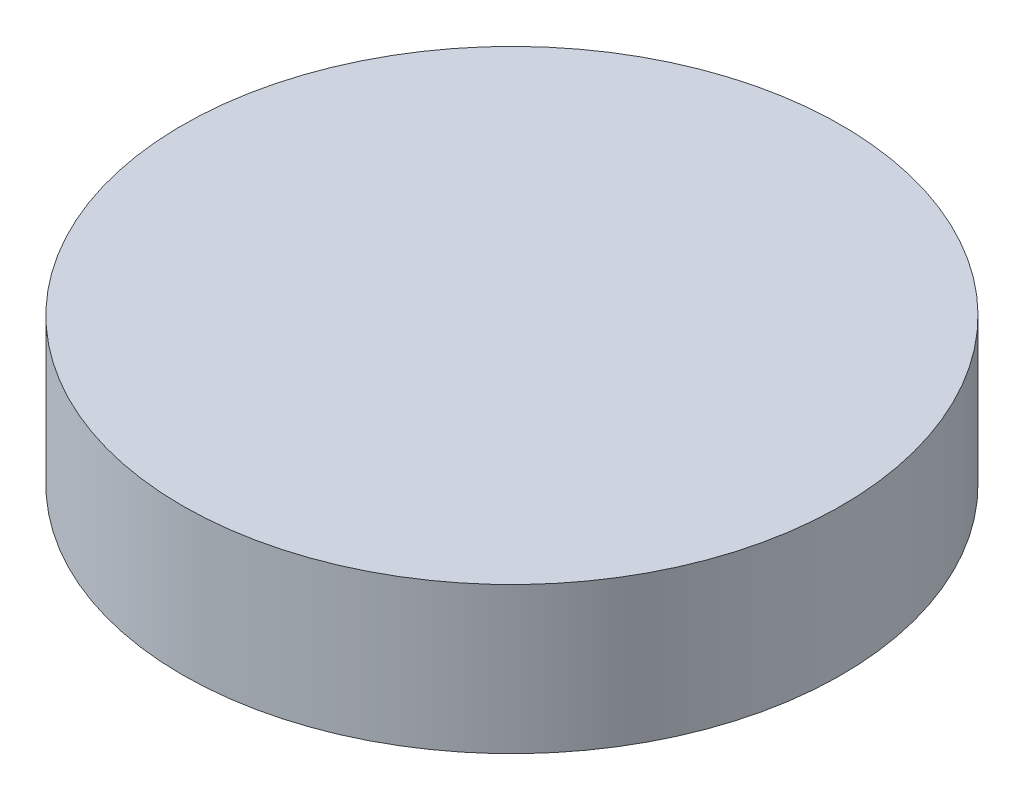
SolidWorks part; units mm, degrees
ref_plane "Plan de face" through (0, 0, 0) normal (0, 0, 1) x (1, 0, 0)
ref_plane "Plan de dessus" through (0, 0, 0) normal (0, 1, 0) x (1, 0, 0)
ref_plane "Plan de droite" through (0, 0, 0) normal (1, 0, 0) x (0, 0, -1)
sketch "Esquisse1" plane through (0, 0, 0) normal (0, 1, 0) x (1, 0, 0)
  circle A0 centre (0, 0) radius 4.5
  dimension "D1" = 9
extrude "Boss.-Extru.1" add sketch "Esquisse1" along normal blind 2
